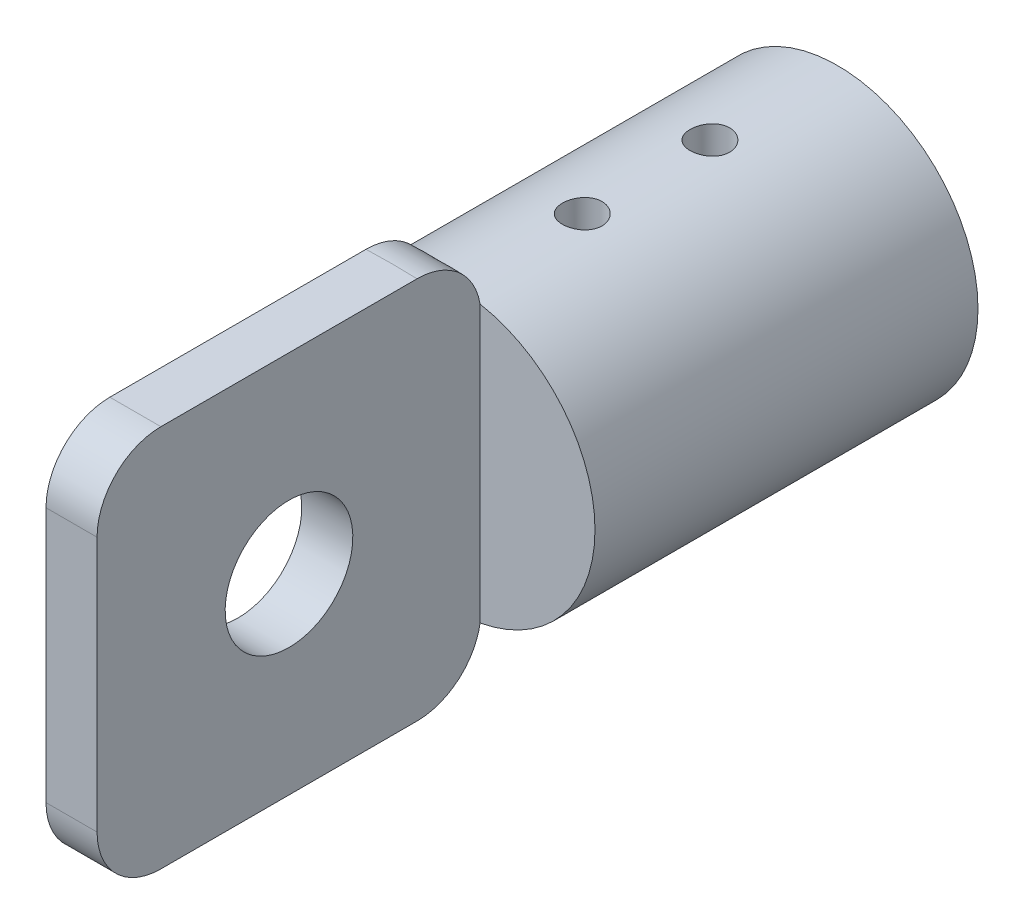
SolidWorks part; units mm, degrees
ref_plane "前视基准面" through (0, 0, 0) normal (0, 0, 1) x (1, 0, 0)
ref_plane "上视基准面" through (0, 0, 0) normal (0, 1, 0) x (1, 0, 0)
ref_plane "右视基准面" through (0, 0, 0) normal (1, 0, 0) x (0, 0, -1)
other "Configuration Table"
sketch "草图1" plane through (0, 0, 0) normal (0, 0, 1) x (1, 0, 0)
  circle A0 centre (0, 0) radius 11
extrude "凸台-拉伸1" add sketch "草图1" along normal blind 30
sketch "草图2" plane through (0, 0, 0) normal (0, 0, -1) x (-1, 0, 0)
  circle A0 centre (0, 0) radius 8
extrude "切除-拉伸1" cut sketch "草图2" against normal blind 25
ref_point "点1"
ref_plane "基准面1" through (0, 0, 0) normal (0, 1, 0) x (1, 0, 0)
sketch "草图4" plane through (0, 0, 0) normal (0, 1, 0) x (1, 0, 0)
  circle A0 centre (0, -10) radius 1.55
  circle A1 centre (0, -20) radius 1.55
  point P7 (2.8097, -9.6844)
  dimension "D1" = 10
  dimension "D2" = 10
extrude "切除-拉伸2" cut sketch "草图4" against normal through all and the other way through all
sketch "草图5" plane through (0, 0, 30) normal (0, 0, 1) x (1, 0, 0)
  line L1 (-2, 15) -> (2, 15)
  line L2 (-2, 15) -> (-2, -15)
  line L3 (-2, -15) -> (2, -15)
  line L4 (2, 15) -> (2, -15)
  line L5 (-2, 15) -> (2, -15) construction
  line L6 (-2, -15) -> (2, 15) construction
  point P0 (0, 0)
extrude "凸台-拉伸2" add sketch "草图5" along normal blind 30
fillet "圆角1" radius 5 4 edges at (0, -15, 30) (0, -15, 60) (0, 15, 60) (0, 15, 30)
sketch "草图6" plane through (-2, 0, 0) normal (-1, 0, 0) x (0, 0, 1)
  line L0 (12.1, 0) -> (-12.1, 0) construction
  circle A0 centre (44.9676, 0) radius 5
extrude "切除-拉伸3" cut sketch "草图6" against normal through all
